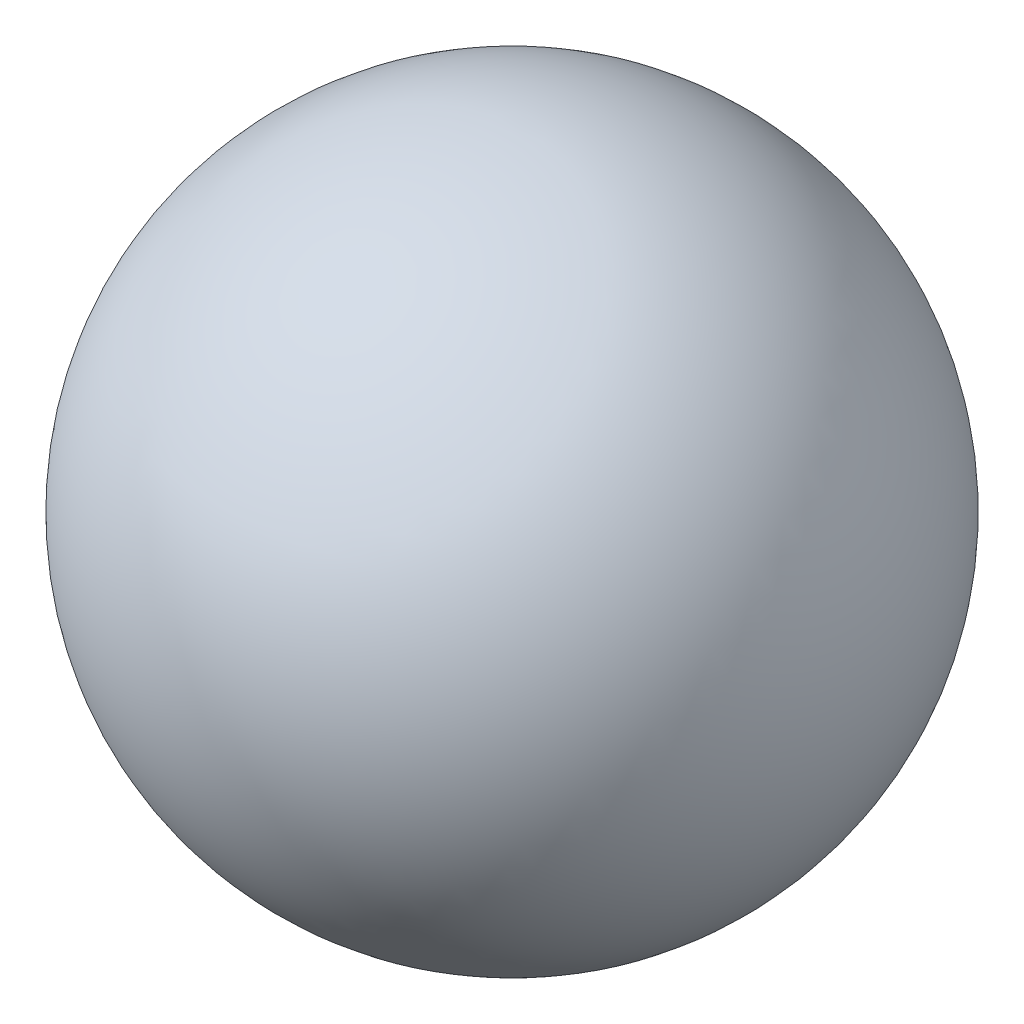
SolidWorks part; units mm, degrees
ref_plane "Plan1" through (0, 0, 0) normal (0, 0, 1) x (1, 0, 0)
ref_plane "Plan2" through (0, 0, 0) normal (0, 1, 0) x (1, 0, 0)
ref_plane "Plan3" through (0, 0, 0) normal (1, 0, 0) x (0, 0, -1)
sketch "Esquisse1" plane through (0, 0, 0) normal (1, 0, 0) x (0, 0, -1)
  line L1 (0, 1.4) -> (0, -1.4)
  line L2 (0, 1.4) -> (0, 11) construction
  arc A0 (0, 1.4) -> (0, -1.4) centre (0, 0) ccw
  dimension "D1" = 2.8
revolve "Base-Révolution" add sketch "Esquisse1" angle 360 about L2
